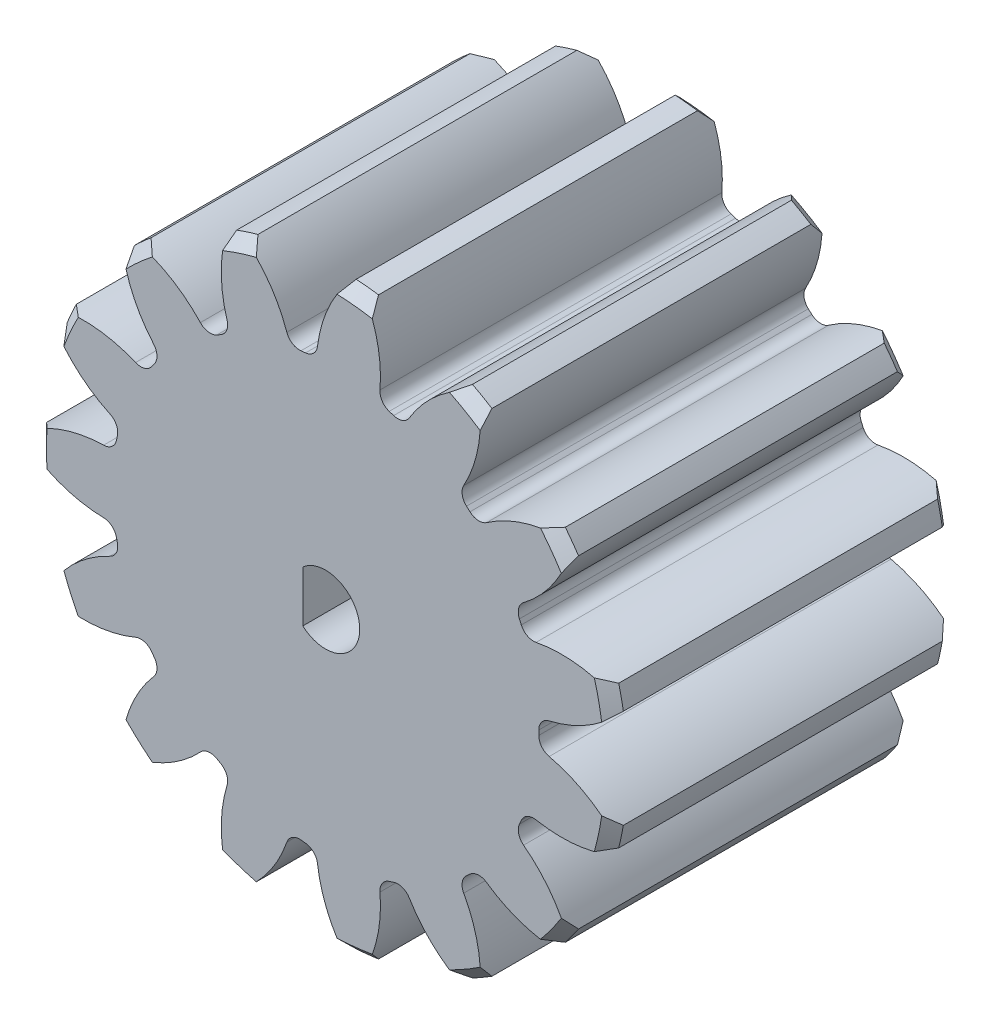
SolidWorks part; units mm, degrees
ref_plane "Front Plane" through (0, 0, 0) normal (0, 0, 1) x (1, 0, 0)
ref_plane "Top Plane" through (0, 0, 0) normal (0, 1, 0) x (1, 0, 0)
ref_plane "Right Plane" through (0, 0, 0) normal (1, 0, 0) x (0, 0, -1)
sketch "Sketch1" plane through (0, 0, 0) normal (0, 0, 1) x (1, 0, 0)
  line L0 (0, 0) -> (0, 11.25) construction
  line L1 (-3.6157, 12.566) -> (3.6157, 9.934) construction
  circle A0 centre (0, 0) radius 9.375 construction
  circle A1 centre (0, 0) radius 12.75 construction
  circle A2 centre (0, 0) radius 11.25 construction
  circle A3 centre (0, 0) radius 10.5715 construction
  circle A4 centre (0, 0) radius 9 construction
  circle A5 centre (0, 0) radius 4 construction
  point P8 (0.75, 0)
  point P13 (7.5, 0)
sketch "Sketch2" plane through (0, 0, 0) normal (1, 0, 0) x (0, 0, -1)
  line L0 (-14, 0) -> (15, 0) construction
  line L1 (15, 12.75) -> (15, -12.75) construction
  line L2 (0, -9) -> (-14, -9) construction
  line L3 (-14, 12.75) -> (15, 12.75) construction
  line L8 (-14, -9) -> (-14, 9) construction
  point P4 (0, 12.75)
  point P5 (-7, 0)
sketch "Sketch3" plane through (0, 0, 0) normal (0, 0, 1) x (1, 0, 0)
  circle A0 centre (0, 0) radius 12.75
  circle A1 centre (0, 0) radius 12.75 construction
extrude "Boss-Extrude1" add sketch "Sketch3" against normal up to vertex and the other way up to vertex
sketch "Sketch5" plane through (0, 0, 0) normal (1, 0, 0) x (0, 0, -1)
  line L1 (0, 9) -> (-14, 9)
  line L2 (0, 9) -> (0, 12.75)
  line L3 (0, 12.75) -> (-14, 12.75)
  line L4 (-14, 9) -> (-14, 12.75)
  line L5 (-14, 0) -> (15, 0)
  line L6 (-14, 0) -> (-14, 4)
  line L7 (-14, 4) -> (15, 4)
  line L8 (15, 0) -> (15, 4)
  point P5 (0, 9)
  point P12 (0, 4)
revolve "Cut-Revolve1" cut sketch "Sketch5" angle 360 about L0
fillet "Fillet2" radius 0.5033 1 edges at (0, -9, 0)
chamfer "Chamfer1" distance 0.5033 angle 45 5 edges at (0, -4, -15) (0, -12.75, 0) (12.75, 0, -15) (0, -4, 14) (0, -9, 14)
sketch "Sketch4" plane through (0, 0, 0) normal (0, 0, 1) x (1, 0, 0)
  line L0 (9.3565, 0.589) -> (9.3565, -0.589)
  arc A3 (12.5644, 2.1675) -> (12.5644, -2.1675) centre (0, 0) cw
  circle A4 centre (0, 0) radius 12.75 construction
  arc A5 (9.3565, 0.589) -> (12.5644, 2.1675) centre (8.4692, 6.4413) ccw
  circle A8 centre (0, 0) radius 9.375 construction
  arc A9 (9.3565, -0.589) -> (12.5644, -2.1675) centre (8.4692, -6.4413) cw
  spline S0 degree 4 poles (10.5289, 0.9482) (10.5325, 0.9486) (10.5424, 0.9498) (10.561, 0.9526) (10.5913, 0.9582) (10.6297, 0.9665) (10.6791, 0.9788) (10.737, 0.9951) (10.8001, 1.015) (10.8684, 1.0388) (10.9361, 1.0643) (11.0031, 1.0915) (11.0695, 1.1202) (11.1494, 1.1567) (11.2445, 1.203) (11.3544, 1.2607) (11.4777, 1.3305) (11.6018, 1.4061) (11.7225, 1.4842) (11.8428, 1.5673) (11.958, 1.6507) (12.0758, 1.7415) (12.1836, 1.8275) (12.3023, 1.9285) (12.3975, 2.0113) (12.5207, 2.1254) (12.5927, 2.1943) (12.6762, 2.2765) (12.7128, 2.3138) (12.7354, 2.3368) knots 0 0 0 0 0 0.005377 0.015084 0.028532 0.04661 0.064855 0.092111 0.119476 0.146842 0.174209 0.201575 0.228941 0.256307 0.307035 0.361767 0.4165 0.471232 0.525964 0.580697 0.635429 0.690161 0.744894 0.799626 0.854358 0.909091 0.954545 1 1 1 1 1 construction
  spline S1 degree 4 poles (10.5289, 0.9482) (10.5325, 0.9486) (10.5424, 0.9498) (10.561, 0.9526) (10.5913, 0.9582) (10.6297, 0.9665) (10.6791, 0.9788) (10.737, 0.9951) (10.8001, 1.015) (10.8684, 1.0388) (10.9361, 1.0643) (11.0031, 1.0915) (11.0695, 1.1202) (11.1494, 1.1567) (11.2445, 1.203) (11.3544, 1.2607) (11.4777, 1.3305) (11.6018, 1.4061) (11.7225, 1.4842) (11.8428, 1.5673) (11.958, 1.6507) (12.0758, 1.7415) (12.1836, 1.8275) (12.3023, 1.9285) (12.3975, 2.0113) (12.494, 2.1007) (12.5407, 2.1447) (12.5644, 2.1675) knots 0 0 0 0 0 0.005377 0.015084 0.028532 0.04661 0.064855 0.092111 0.119476 0.146842 0.174209 0.201575 0.228941 0.256307 0.307035 0.361767 0.4165 0.471232 0.525964 0.580697 0.635429 0.690161 0.744894 0.799626 0.854358 0.909091 0.909091 0.909091 0.909091 0.909091 construction
  spline S2 degree 4 poles (10.5289, -0.9482) (10.5325, -0.9486) (10.5424, -0.9498) (10.561, -0.9526) (10.5913, -0.9582) (10.6297, -0.9665) (10.6791, -0.9788) (10.737, -0.9951) (10.8001, -1.015) (10.8684, -1.0388) (10.9361, -1.0643) (11.0031, -1.0915) (11.0695, -1.1202) (11.1494, -1.1567) (11.2445, -1.203) (11.3544, -1.2607) (11.4777, -1.3305) (11.6018, -1.4061) (11.7225, -1.4842) (11.8428, -1.5673) (11.958, -1.6507) (12.0758, -1.7415) (12.1836, -1.8275) (12.3023, -1.9285) (12.3975, -2.0113) (12.5207, -2.1254) (12.5927, -2.1943) (12.6762, -2.2765) (12.7128, -2.3138) (12.7354, -2.3368) knots 0 0 0 0 0 0.005377 0.015084 0.028532 0.04661 0.064855 0.092111 0.119476 0.146842 0.174209 0.201575 0.228941 0.256307 0.307035 0.361767 0.4165 0.471232 0.525964 0.580697 0.635429 0.690161 0.744894 0.799626 0.854358 0.909091 0.954545 1 1 1 1 1 construction
  spline S3 degree 4 poles (10.5289, -0.9482) (10.5325, -0.9486) (10.5424, -0.9498) (10.561, -0.9526) (10.5913, -0.9582) (10.6297, -0.9665) (10.6791, -0.9788) (10.737, -0.9951) (10.8001, -1.015) (10.8684, -1.0388) (10.9361, -1.0643) (11.0031, -1.0915) (11.0695, -1.1202) (11.1494, -1.1567) (11.2445, -1.203) (11.3544, -1.2607) (11.4777, -1.3305) (11.6018, -1.4061) (11.7225, -1.4842) (11.8428, -1.5673) (11.958, -1.6507) (12.0758, -1.7415) (12.1836, -1.8275) (12.3023, -1.9285) (12.3975, -2.0113) (12.494, -2.1007) (12.5407, -2.1447) (12.5644, -2.1675) knots 0 0 0 0 0 0.005377 0.015084 0.028532 0.04661 0.064855 0.092111 0.119476 0.146842 0.174209 0.201575 0.228941 0.256307 0.307035 0.361767 0.4165 0.471232 0.525964 0.580697 0.635429 0.690161 0.744894 0.799626 0.854358 0.909091 0.909091 0.909091 0.909091 0.909091 construction
extrude "Cut-Extrude1" cut sketch "Sketch4" against normal through all both and the other way through all
fillet "Fillet1" radius 0.589 2 edges at (9.3565, 0.589, -7.4917) (9.3565, -0.589, -7.4917)
pattern_circular "CirPattern1" count 15 over 360 about axis through (0, 0, 0) along (0, 0, 1) of "Cut-Extrude1", "Fillet1"
sketch "Sketch6" plane through (0, 0, -15) normal (0, 0, -1) x (-1, 0, 0)
  circle A0 centre (0, 0) radius 9.0869
extrude "Boss-Extrude3" add sketch "Sketch6" against normal up to surface (29 mm away)
sketch "Sketch7" plane through (0, 0, 14) normal (0, 0, 1) x (1, 0, 0)
  circle A3 centre (0, 0) radius 15.929
extrude "Cut-Extrude2" cut sketch "Sketch7" against normal blind 14
sketch "Sketch8" plane through (0, 0, 0) normal (0, 0, 1) x (1, 0, 0)
  line L0 (-0.9978, 1.12) -> (-0.9978, -1.12)
  arc A0 (-0.9978, -1.12) -> (-0.9978, 1.12) centre (0, 0) ccw
  dimension "D1" = 2.24
extrude "Cut-Extrude3" cut sketch "Sketch8" against normal blind 9
equation "\"Number of Teeth\"= 15"
equation "\"Module\"= 1.5"
equation "\"Diametral Pitch\"= 1 / \"Module\""
equation "\"Dedendum\"= 1.25 / \"Diametral Pitch\""
equation "\"Pitch Diameter\"= \"Module\" * \"Number of Teeth\""
equation "\"Root Diameter\"= \"Pitch Diameter\" - ( 2 * \"Dedendum\" )"
equation "\"Root Diameter@Sketch1\"=\"Root Diameter\""
equation "\"OD@Sketch1\" = \"Outside Diameter\""
equation "\"D1@CirPattern1\"=\"Number of Teeth\""
equation "\"Pressure Angle\"=20"
equation "\"Base Diameter\"= \"Pitch Diameter\" * cos ( \"Pressure Angle\" )"
equation "\"Outside Diameter\"= ( \"Number of Teeth\" + 2 ) / \"Diametral Pitch\""
equation "\"Pitch Angle\"= 360deg / \"Number of Teeth\""
equation "\"Alpha\"= sqr ( \"Pitch Diameter\" ^ 2 - \"Base Diameter\" ^ 2 ) / \"Base Diameter\" * 180 / PI - \"Pressure Angle\""
equation "\"Beta\"= ( \"Pitch Angle\" / 4 - \"Alpha\" )"
equation "\"Phi\"= sqr ( ( \"Outside Diameter\" / 2 ) ^ 2 - ( \"Base Diameter\" / 2 ) ^ 2 ) / ( \"Base Diameter\" / 2 )"
equation "\"Addendum\"= 1 / \"Diametral Pitch\""
equation "\"WorkingDepth\"= 2 / \"Diametral Pitch\""
equation "\"WholeDepth\"= 2.25 / \"Diametral Pitch\""
equation "\"Clearance\"= 0.25 / \"Diametral Pitch\""
equation "\"ToothThickness\"= ( pi * 2 ) / \"Diametral Pitch\""
equation "\"CircularPitch\"= pi / \"Diametral Pitch\""
equation "\"Number of Teeth@Sketch1\"=\"Number of Teeth\""
equation "\"Module@Sketch1\"=\"Module\""
equation "\"Pressure Angle@Sketch1\"=\"Pressure Angle\""
equation "\"Gear Pitch Diameter@Sketch1\"=\"Pitch Diameter\""
equation "\"Base Diameter@Sketch1\"=\"Base Diameter\""
equation "\"Fillet\"= \"Clearance\" * cos ( \"Pressure Angle\" ) * tan ( ( 90 + \"Pressure Angle\" ) / 2 )"
equation "\"D1@Fillet2\"=\"Fillet\""
equation "\"Approx Set Screw Positon@Sketch2\" = \"Hub Width@Sketch2\" / 2"
equation "\"D2\"= \"Fillet\" * 2"
equation "\"D1@Chamfer1\"=\"Fillet\""
equation "\"D1@Sketch4\"=\"CircularPitch\"*0.25"
equation "\"D1@Fillet1\"=\"CircularPitch\"*0.125"
